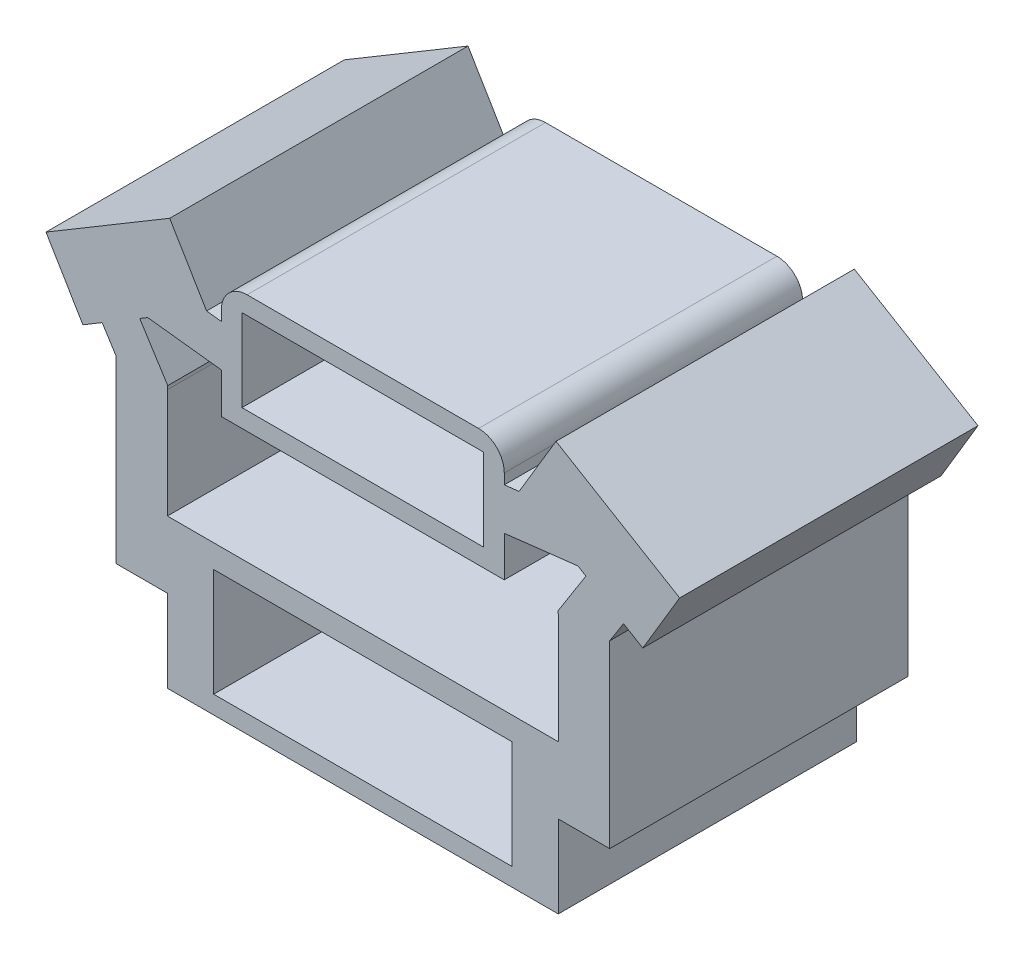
SolidWorks part; units mm, degrees
ref_plane "前视基准面" through (0, 0, 0) normal (0, 0, 1) x (1, 0, 0)
ref_plane "上视基准面" through (0, 0, 0) normal (0, 1, 0) x (1, 0, 0)
ref_plane "右视基准面" through (0, 0, 0) normal (1, 0, 0) x (0, 0, -1)
other "Configuration Table"
sketch "草图1" plane through (0, 0, 0) normal (0, 0, 1) x (1, 0, 0)
  line L0 (2.75, 5.2) -> (3.0381, 5.2333)
  line L1 (-3.8, -1.4) -> (3.8, -1.4)
  line L2 (-3.8, -1.4) -> (-3.8, 1.4)
  line L4 (3.8, -1.4) -> (3.8, 0.1)
  line L5 (-3.8, -1.4) -> (3.8, 1.4) construction
  line L6 (-3.8, 1.4) -> (3.8, -1.4) construction
  line L7 (-2.75, 5.2) -> (2.75, 5.2)
  line L8 (-2.75, 5.2) -> (-2.75, 3.6)
  line L9 (-2.75, 3.6) -> (2.75, 3.6)
  line L10 (2.75, 4.3846) -> (2.75, 3.6)
  line L11 (-2.75, 5.2) -> (2.75, 3.6) construction
  line L12 (-2.75, 3.6) -> (2.75, 5.2) construction
  line L14 (3.8, 0.1) -> (4.8, 0.1)
  line L17 (3.7554, 6.4356) -> (3.0381, 5.2333)
  line L19 (3.7554, 6.4356) -> (6.1599, 5.0009)
  line L33 (2.75, 5.2) -> (2.75, 4.3846) construction
  line L34 (3.0381, 5.2333) -> (4.1827, 4.5504) construction
  line L37 (4.8, 3.6) -> (4.8, 0.1)
  line L38 (-3.8, 1.4) -> (3.8, 1.4)
  line L39 (3.8, 1.4) -> (3.8, 0.1) construction
  line L40 (0, 9.062) -> (0, -4.0269) construction
  line L41 (2.75, 4.3846) -> (4.1827, 4.5504)
  line L48 (4.1827, 4.5504) -> (4.3377, 4.4579)
  line L51 (3.7933, 3.6) -> (4.3377, 4.4579)
  line L53 (5.0679, 4.0222) -> (5.4426, 3.7986)
  line L55 (4.3377, 4.4579) -> (5.0679, 4.0222) construction
  line L56 (3.7933, 3.6) -> (4.8, 3.6) construction
  line L57 (3.8, 1.4) -> (3.8, 3.6)
  line L58 (3.8, 3.6) -> (3.7933, 3.6)
  line L59 (4.8, 3.6) -> (5.0679, 4.0222)
  line L60 (5.4426, 3.7986) -> (6.1599, 5.0009)
  point P0 (0, 0)
  point P6 (0, 4.4)
  dimension "D1" = 7.6
  dimension "D2" = 2.8
  dimension "D3" = 5.5
  dimension "D4" = 1.6
  dimension "D5" = 1
  dimension "D6" = 57.6
  dimension "D7" = 0.29
  dimension "D8" = 0.81
  dimension "D9" = 3.5
  dimension "D10" = 1.4
  dimension "D11" = 0.85
  dimension "D12" = 2.2
  dimension "D13" = 0.5
  dimension "D14" = 2.2
  dimension "D15" = 2.8
  dimension "D16" = 96.6
extrude "凸台-拉伸1" add sketch "草图1" along normal blind 5.8
mirror "镜向1" about plane through (0, 0, 0) normal (1, 0, 0) of "凸台-拉伸1"
sketch "草图10" plane through (0, 0, 5.8) normal (0, 0, 1) x (1, 0, 0)
  line L0 (-2.75, 3.6) -> (2.75, 3.6) construction
  line L1 (-2.9, -1.05) -> (2.9, -1.05)
  line L2 (-2.9, -1.05) -> (-2.9, 1.05)
  line L3 (-2.9, 1.05) -> (2.9, 1.05)
  line L4 (2.9, -1.05) -> (2.9, 1.05)
  line L5 (-2.9, -1.05) -> (2.9, 1.05) construction
  line L6 (-2.9, 1.05) -> (2.9, -1.05) construction
  line L7 (-2.35, 5.55) -> (2.35, 5.55)
  line L8 (-2.35, 5.55) -> (-2.35, 3.95)
  line L9 (-2.35, 3.95) -> (2.35, 3.95)
  line L10 (2.35, 5.55) -> (2.35, 3.95)
  point P0 (0, 0)
  point P10 (0, 5.55)
  dimension "D1" = 5.8
  dimension "D2" = 2.1
  dimension "D3" = 4.7
  dimension "D4" = 1.6
  dimension "D5" = 0.35
extrude "切除-拉伸3" cut sketch "草图10" against normal through all
sketch "草图11" plane through (0, 0, 5.8) normal (0, 0, 1) x (1, 0, 0)
  line L0 (-2.35, 5.2) -> (-2.75, 5.2)
  line L1 (-2.75, 5.2) -> (-2.75, 5.9)
  line L2 (-2.75, 5.9) -> (2.75, 5.9)
  line L3 (2.75, 5.9) -> (2.75, 5.2)
  line L4 (2.75, 3.6) -> (2.75, 4.3846) construction
  line L5 (2.75, 5.2) -> (2.35, 5.2)
  line L6 (2.35, 5.2) -> (2.35, 5.55)
  line L7 (2.35, 5.55) -> (-2.35, 5.55)
  line L8 (-2.35, 5.55) -> (-2.35, 5.2)
  line L9 (-2.35, 3.95) -> (2.35, 3.95) construction
  dimension "D1" = 0.35
  dimension "D2" = 1.6
extrude "凸台-拉伸2" add sketch "草图11" against normal up to surface (5.8 mm away)
fillet "圆角1" radius 0.5 2 edges at (-2.75, 5.9, 2.9) (2.75, 5.9, 2.9)
sketch "草图12" plane through (0, 0, 5.8) normal (0, 0, 1) x (1, 0, 0)
  line L0 (-2.9, 1.05) -> (-2.9, -1.05) construction
  line L1 (-2.9, 0.95) -> (2.9, 0.95)
  line L2 (-2.9, 0.95) -> (-2.9, 1.05)
  line L3 (-2.9, 1.05) -> (2.9, 1.05)
  line L4 (2.9, 0.95) -> (2.9, 1.05)
  line L5 (3.8, -1.4) -> (3.8, 0.1) construction
  line L6 (-3.8, -1.4) -> (3.8, -1.4)
  line L7 (-3.8, -1.4) -> (-3.8, -1.5)
  line L8 (-3.8, -1.5) -> (3.8, -1.5)
  line L9 (3.8, -1.4) -> (3.8, -1.5)
  dimension "D1" = 0.1
  dimension "D2" = 0.1
extrude "凸台-拉伸3" add sketch "草图12" against normal up to surface (5.8 mm away)
sketch "草图14" plane through (0, 0, 5.8) normal (0, 0, 1) x (1, 0, 0)
  line L0 (2.9, -1.05) -> (2.9, 0.95) construction
  line L1 (-2.9, -1.05) -> (2.9, -1.05)
  line L2 (-2.9, -1.05) -> (-2.9, -1.15)
  line L3 (-2.9, -1.15) -> (2.9, -1.15)
  line L4 (2.9, -1.05) -> (2.9, -1.15)
  dimension "D1" = 0.1
extrude "切除-拉伸4" cut sketch "草图14" against normal through all
sketch "草图15" plane through (0, 0, 5.8) normal (0, 0, 1) x (1, 0, 0)
  line L0 (0, 5.2) -> (0, 1.4)
  line L2 (3.8, 1.4) -> (-3.8, 1.4) construction
  line L3 (0, 1.4) -> (3.8, 1.4)
  line L4 (3.8, 1.4) -> (3.8, 3.6)
  line L5 (3.8, 3.6) -> (4.8, 3.6)
  line L6 (4.8, 3.6) -> (5.0679, 4.0222)
  line L7 (5.0679, 4.0222) -> (3.0381, 5.2333)
  line L8 (3.0381, 5.2333) -> (2.75, 5.2)
  line L9 (2.75, 5.2) -> (0, 5.2)
sketch "草图16" plane through (0, 0, 5.8) normal (0, 0, 1) x (1, 0, 0)
  line L0 (-2.35, 5.55) -> (-2.35, 3.95) construction
  line L1 (-2.35, 4.05) -> (2.35, 4.05)
  line L2 (-2.35, 4.05) -> (-2.35, 3.95)
  line L3 (-2.35, 3.95) -> (2.35, 3.95)
  line L4 (2.35, 4.05) -> (2.35, 3.95)
  dimension "D1" = 0.1
extrude "凸台-拉伸4" [suppressed] add sketch "草图16" against normal up to surface (5.8 mm away)
fillet "圆角2" radius 0.4 2 edges at (-3.8, 3.6, 2.9) (3.8, 3.6, 2.9)
sketch "草图17" plane through (0, 0, 5.8) normal (0, 0, 1) x (1, 0, 0)
  line L0 (-2.9, 2.0221) -> (-2.9, -1.8376)
  line L1 (-2.35, 6.4076) -> (-2.35, 2.8612)
